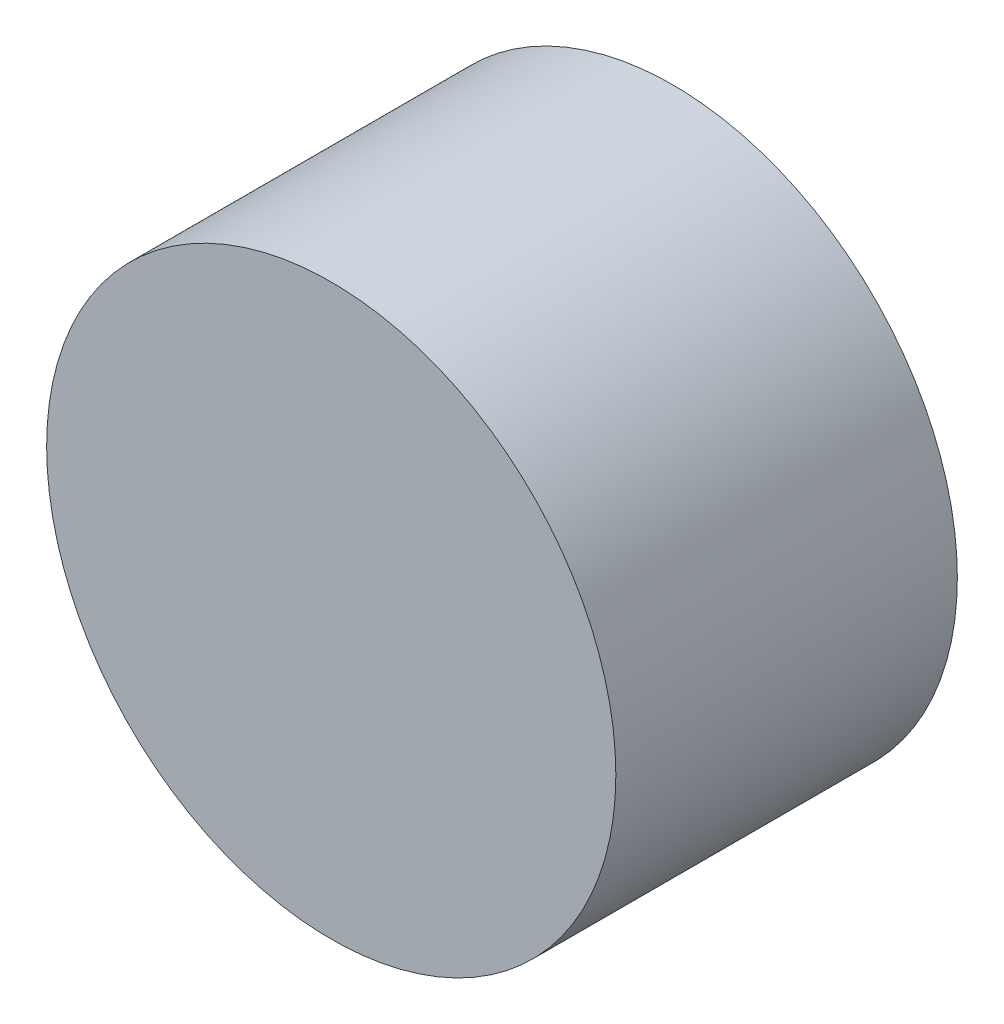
SolidWorks part; units mm, degrees
ref_plane "Plan de face" through (0, 0, 0) normal (0, 0, 1) x (1, 0, 0)
ref_plane "Plan de dessus" through (0, 0, 0) normal (0, 1, 0) x (1, 0, 0)
ref_plane "Plan de droite" through (0, 0, 0) normal (1, 0, 0) x (0, 0, -1)
sketch "Esquisse1" plane through (0, 0, 0) normal (0, 0, 1) x (1, 0, 0)
  circle A0 centre (0, 0) radius 2.5
  dimension "D1" = 5
extrude "Boss.-Extru.1" add sketch "Esquisse1" along normal blind 3
